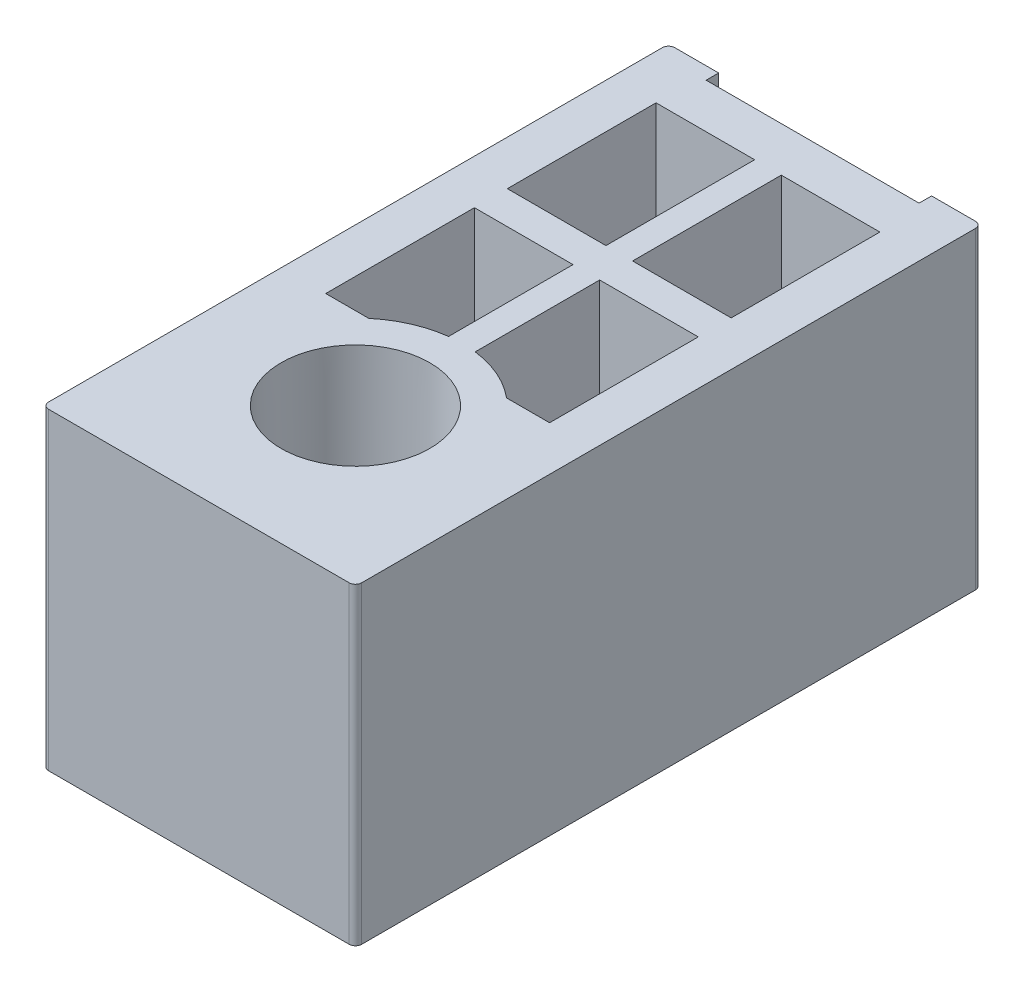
SolidWorks part; units mm, degrees
ref_plane "Plan de face" through (0, 0, 0) normal (0, 0, 1) x (1, 0, 0)
ref_plane "Plan de dessus" through (0, 0, 0) normal (0, 1, 0) x (1, 0, 0)
ref_plane "Plan de droite" through (0, 0, 0) normal (1, 0, 0) x (0, 0, -1)
sketch "Esquisse1" plane through (0, 0, 0) normal (0, 1, 0) x (1, 0, 0)
  line L0 (0, -20.2628) -> (0, 58.4186) construction
  line L1 (-24.3225, 0) -> (29.7425, 0) construction
  line L2 (25, -20.2628) -> (25, 58.4186) construction
  line L3 (-24.3225, 50) -> (34.6841, 50) construction
  line L4 (4, 55.6667) -> (4, -3.7395) construction
  line L5 (-3.5126, 49) -> (27.2256, 49) construction
  line L6 (-17.7609, 25) -> (23.5775, 25) construction
  line L7 (12.5, 55.6667) -> (12.5, -13.5587) construction
  line L8 (0.5, 0) -> (24.5, 0)
  line L9 (21, 55.6667) -> (21, -3.7395) construction
  line L10 (-3.5126, 1) -> (27.2256, 1) construction
  line L11 (4, 49) -> (21, 49)
  line L12 (4, 49) -> (4, 50)
  line L14 (21, 49) -> (21, 50)
  line L17 (21, 50) -> (24.5, 50)
  line L19 (0.5, 50) -> (4, 50)
  line L20 (0, 49.5) -> (0, 0.5)
  line L22 (25, 49.5) -> (25, 0.5)
  arc A0 (0.5, 50) -> (0, 49.5) centre (0.5, 49.5) ccw
  arc A1 (24.5, 50) -> (25, 49.5) centre (24.5, 49.5) cw
  arc A2 (24.5, 0) -> (25, 0.5) centre (24.5, 0.5) ccw
  arc A3 (0, 0.5) -> (0.5, 0) centre (0.5, 0.5) ccw
  dimension "D6" = 0.5
  dimension "D1" = 25
  dimension "D2" = 50
  dimension "D3" = 25
  dimension "D4" = 12.5
  dimension "D5" = 4
  dimension "D7" = 1
extrude "Extrusion1" add sketch "Esquisse1" along normal blind 25
sketch "Esquisse2" plane through (0, 0, 0) normal (0, -1, 0) x (1, 0, 0)
  line L0 (0, 9.4676) -> (0, -60.8727) construction
  line L1 (-5.7031, 0) -> (29.0572, 0) construction
  line L2 (29.0572, -25) -> (-5.7031, -25) construction
  line L3 (12.5, 9.4676) -> (12.5, -60.8727) construction
  line L4 (4, 9.4676) -> (4, -52.8814) construction
  line L5 (9.6643, -12.5) -> (19.7875, -12.5) construction
  line L6 (-5.7031, -5) -> (39.022, -5) construction
  line L7 (-5.7031, -16) -> (39.022, -16) construction
  line L8 (-5.7031, -19.5) -> (39.022, -19.5) construction
  line L9 (11, -52.8814) -> (11, 9.4676) construction
  line L10 (-5.7031, -45) -> (39.022, -45) construction
  line L11 (-5.7031, -34) -> (39.022, -34) construction
  line L12 (-5.7031, -30.5) -> (39.022, -30.5) construction
  line L13 (4, -45) -> (11, -45)
  line L14 (4, -45) -> (4, -34)
  line L15 (4, -34) -> (11, -34)
  line L16 (11, -45) -> (11, -34)
  line L17 (4, -30.5) -> (11, -30.5)
  line L18 (4, -30.5) -> (4, -19.5)
  line L19 (4, -19.5) -> (6.8431, -19.5)
  line L20 (11, -21.3741) -> (11, -30.5)
  line L21 (21, -19.5) -> (18.1569, -19.5)
  line L22 (14, -21.3741) -> (14, -30.5)
  line L23 (21, -30.5) -> (14, -30.5)
  line L24 (21, -30.5) -> (21, -19.5)
  line L32 (14, -45) -> (14, -34)
  line L33 (21, -34) -> (14, -34)
  line L34 (21, -45) -> (21, -34)
  line L35 (21, -45) -> (14, -45)
  circle A0 centre (12.5, -12.5) radius 5.5
  arc A1 (14, -21.3741) -> (18.1569, -19.5) centre (12.5, -12.5) ccw
  arc A3 (6.8431, -19.5) -> (11, -21.3741) centre (12.5, -12.5) ccw
  dimension "D1" = 25
  dimension "D2" = 12.5
  dimension "D3" = 1.5
  dimension "D4" = 5
  dimension "D5" = 11
  dimension "D6" = 3.5
  dimension "D7" = 4
  dimension "D8" = 12.5
extrude "Enlèv. mat.-Extru.1" cut sketch "Esquisse2" against normal blind 25 draft 1
